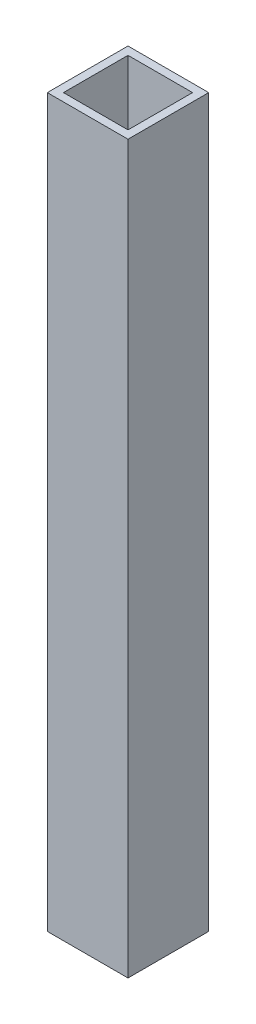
SolidWorks part; units mm, degrees
ref_plane "Front" through (0, 0, 0) normal (0, 0, 1) x (1, 0, 0)
ref_plane "Top" through (0, 0, 0) normal (0, 1, 0) x (1, 0, 0)
ref_plane "Right" through (0, 0, 0) normal (1, 0, 0) x (0, 0, -1)
sketch "草图1" plane through (0, 0, 0) normal (0, 1, 0) x (1, 0, 0)
  line L0 (1, 1) -> (9, 1)
  line L1 (0, 0) -> (10, 0)
  line L2 (0, 0) -> (0, 10)
  line L3 (0, 10) -> (10, 10)
  line L4 (10, 0) -> (10, 10)
  line L5 (9, 1) -> (9, 9)
  line L6 (1, 9) -> (9, 9)
  line L7 (1, 1) -> (1, 9)
  dimension "D1" = 10
  dimension "D2" = 10
  dimension "D3" = 1
extrude "凸台-拉伸1" add sketch "草图1" along normal blind 90
